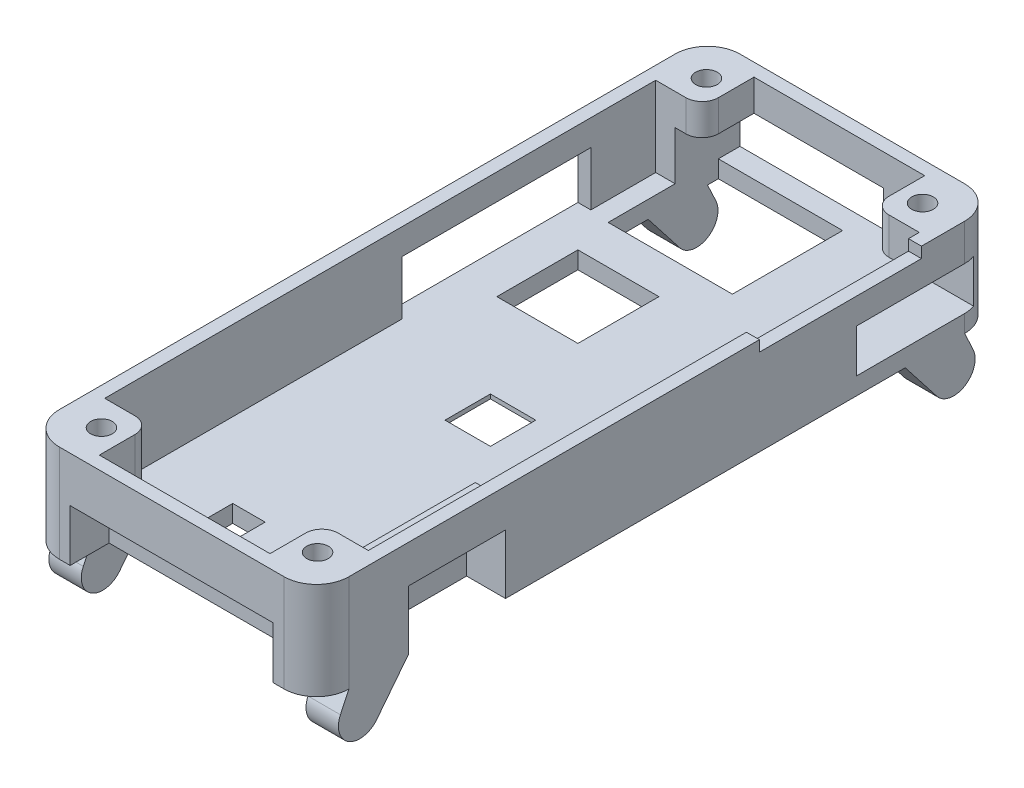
SolidWorks part; units mm, degrees
ref_plane "前视基准面" through (0, 0, 0) normal (0, 0, 1) x (1, 0, 0)
ref_plane "上视基准面" through (0, 0, 0) normal (0, 1, 0) x (1, 0, 0)
ref_plane "右视基准面" through (0, 0, 0) normal (1, 0, 0) x (0, 0, -1)
sketch "草图1" plane through (0, 0, 0) normal (0, 1, 0) x (1, 0, 0)
  line L1 (-13.4, 31.5) -> (13.4, 31.5)
  line L2 (-13.4, 31.5) -> (-13.4, -31.5)
  line L3 (-13.4, -31.5) -> (13.4, -31.5)
  line L4 (13.4, 31.5) -> (13.4, -31.5)
  line L5 (-13.4, 31.5) -> (13.4, -31.5) construction
  line L6 (-13.4, -31.5) -> (13.4, 31.5) construction
  point P0 (0, 0)
  dimension "D1" = 26.8
  dimension "D2" = 63
extrude "凸台-拉伸1" add sketch "草图1" along normal blind 9
fillet "圆角1" radius 3 4 edges at (-13.4, 4.5, 31.5) (-13.4, 4.5, -31.5) (13.4, 4.5, -31.5) (13.4, 4.5, 31.5)
shell "抽壳1" thickness 1.2
sketch "草图2" plane through (0, 1.6, 0) normal (0, 1, 0) x (1, 0, 0)
  line L0 (-10.4, -31.5) -> (10.4, -31.5) construction
  line L1 (0, 0) -> (0, -37.1655) construction
  line L2 (-10.4, -30.3) -> (10.4, -30.3) construction
  line L3 (12.2, -28.5) -> (12.2, 28.5) construction
  line L4 (10, -26.5) -> (9.4, -26.5)
  line L5 (9.4, -26.5) -> (9.4, -26.6252)
  line L6 (12.2, -28.5) -> (12.2, -26.5)
  line L8 (9.4, -30.3) -> (9.4, -26.6252)
  line L9 (10, -26.5) -> (12.2, -26.5)
  line L10 (9.4, -30.3) -> (10.4, -30.3)
  circle A0 centre (10, -28) radius 2.25 construction
  circle A1 centre (-10, -28) radius 2.25 construction
  arc A2 (10.4, -30.3) -> (12.2, -28.5) centre (10.4, -28.5) ccw construction
  arc A4 (10.4, -30.3) -> (12.2, -28.5) centre (10.4, -28.5) ccw
  arc A6 (10, -26.5) -> (9.4, -26.6252) centre (10, -28) ccw construction
  dimension "D2" = 4.5
  dimension "D6" = 3
  dimension "D1" = 20
  dimension "D3" = 3.5
  dimension "D4" = 0.6
  dimension "D5" = 1.5
extrude "凸台-拉伸2" add sketch "草图2" along normal up to surface (7.4 mm away)
sketch "草图3" plane through (0, 9, 0) normal (0, 1, 0) x (1, 0, 0)
  line L0 (13.4, -28.5) -> (13.4, 28.5) construction
  line L1 (-10.4, -31.5) -> (10.4, -31.5) construction
  circle A0 centre (10, -28) radius 1
  dimension "D1" = 2
  dimension "D2" = 3.4
  dimension "D3" = 3.5
mirror "镜向1" about plane through (0, 0, 0) normal (1, 0, 0) of "凸台-拉伸2"
mirror "镜向2" about plane through (0, 0, 0) normal (0, 0, 1) of "镜向1", "凸台-拉伸2"
sketch "草图4" plane through (0, 0, 0) normal (0, -1, 0) x (1, 0, 0)
  line L0 (0, -1000) -> (0, 49000) construction
  line L1 (-9.4, 31.5) -> (9.4, 31.5)
  line L2 (-9.4, 31.5) -> (-9.4, 27.9)
  line L3 (-9.4, 27.9) -> (9.4, 27.9)
  line L4 (9.4, 31.5) -> (9.4, 27.9)
  line L5 (-9.4, 31.5) -> (9.4, 27.9) construction
  line L6 (-9.4, 27.9) -> (9.4, 31.5) construction
  line L7 (-10.4, 31.5) -> (10.4, 31.5) construction
  point P0 (0, 29.7)
  dimension "D1" = 18.8
  dimension "D2" = 3.6
extrude "切除-拉伸1" cut sketch "草图4" against normal blind 4.8
sketch "草图5" plane through (0, 1.6, 0) normal (0, 1, 0) x (1, 0, 0)
  line L0 (9.4, -31.5) -> (-9.4, -31.5) construction
  line L1 (-5.25, -20.6) -> (-2.25, -20.6)
  line L2 (-5.25, -20.6) -> (-5.25, -25.1)
  line L3 (-5.25, -25.1) -> (-2.25, -25.1)
  line L4 (-2.25, -20.6) -> (-2.25, -25.1)
  line L5 (-5.25, -20.6) -> (-2.25, -25.1) construction
  line L6 (-5.25, -25.1) -> (-2.25, -20.6) construction
  line L7 (3.25, -20.6) -> (6.25, -20.6)
  line L8 (3.25, -20.6) -> (3.25, -25.1)
  line L9 (3.25, -25.1) -> (6.25, -25.1)
  line L10 (6.25, -20.6) -> (6.25, -25.1)
  line L11 (3.25, -20.6) -> (6.25, -25.1) construction
  line L12 (3.25, -25.1) -> (6.25, -20.6) construction
  line L13 (-10.4, -31.5) -> (10.4, -31.5) construction
  line L14 (0, -1000) -> (0, 49000) construction
  line L16 (-2.1, 0.1) -> (2.1, 0.1)
  line L17 (-2.1, 0.1) -> (-2.1, -4.1)
  line L18 (-2.1, -4.1) -> (2.1, -4.1)
  line L19 (2.1, 0.1) -> (2.1, -4.1)
  line L20 (-2.1, 0.1) -> (2.1, -4.1) construction
  line L21 (-2.1, -4.1) -> (2.1, 0.1) construction
  point P0 (-3.75, -22.85)
  point P5 (4.75, -22.85)
  point P13 (0, -2)
  dimension "D1" = 6.4
  dimension "D2" = 3
  dimension "D3" = 4.5
  dimension "D4" = 3.75
  dimension "D5" = 4.75
  dimension "D6" = 29.5
  dimension "D7" = 4.2
extrude "切除-拉伸2" cut sketch "草图5" against normal through all
sketch "草图7" plane through (0, 0, 0) normal (0, -1, 0) x (1, 0, 0)
  line L1 (-10.4, -19.3) -> (1.1, -19.3)
  line L2 (-10.4, -19.3) -> (-10.4, -30.3)
  line L3 (-10.4, -30.3) -> (1.1, -30.3)
  line L4 (1.1, -19.3) -> (1.1, -30.3)
  line L5 (-10.4, -19.3) -> (1.1, -30.3) construction
  line L6 (-10.4, -30.3) -> (1.1, -19.3) construction
  line L7 (-13.4, -28.5) -> (-13.4, 28.5) construction
  line L8 (10.4, -31.5) -> (-10.4, -31.5) construction
  line L9 (9.4, 31.5) -> (-9.4, 31.5) construction
  line L10 (-9.6, -8.2) -> (-2.1, -8.2)
  line L11 (-9.6, -8.2) -> (-9.6, -15.7)
  line L12 (-9.6, -15.7) -> (-2.1, -15.7)
  line L13 (-2.1, -8.2) -> (-2.1, -15.7)
  line L14 (-9.6, -8.2) -> (-2.1, -15.7) construction
  line L15 (-9.6, -15.7) -> (-2.1, -8.2) construction
  line L16 (13.4, 28.5) -> (13.4, -28.5) construction
  point P0 (-4.65, -24.8)
  point P10 (-5.85, -11.95)
  dimension "D1" = 11
  dimension "D2" = 11.5
  dimension "D3" = 3
  dimension "D4" = 1.2
  dimension "D5" = 39.7
  dimension "D6" = 7.5
  dimension "D7" = 15.5
extrude "切除-拉伸3" cut sketch "草图7" against normal up to surface (1.6 mm away)
sketch "草图8" plane through (0, 0, 0) normal (0, -1, 0) x (1, 0, 0)
  line L0 (13.4, 28.5) -> (13.4, -28.5) construction
  line L1 (9.4, 23) -> (13.4, 23)
  line L2 (9.4, 23) -> (9.4, 14)
  line L3 (9.4, 14) -> (13.4, 14)
  line L4 (13.4, 23) -> (13.4, 14)
  line L5 (9.4, 23) -> (13.4, 14) construction
  line L6 (9.4, 14) -> (13.4, 23) construction
  line L7 (9.4, 31.5) -> (10.4, 31.5) construction
  point P0 (11.4, 18.5)
  dimension "D1" = 4
  dimension "D2" = 9
  dimension "D3" = 8.5
extrude "切除-拉伸4" cut sketch "草图8" against normal blind 5.5
sketch "草图9" plane through (-13.4, 0, 0) normal (-1, 0, 0) x (0, 0, 1)
  line L0 (-28.5, 0) -> (-29.282, -1.6771)
  line L1 (-25.9199, -3.7373) -> (-23, 0)
  line L2 (-28.5, 0) -> (28.5, 0) construction
  line L3 (-23, 0) -> (-28.5, 0)
  line L4 (-31.5, 0) -> (-28.5, 0) construction
  line L5 (-35.2033, -4.5) -> (-21.0062, -4.5) construction
  arc A0 (-29.282, -1.6771) -> (-25.9199, -3.7373) centre (-27.4836, -2.5157) ccw
  dimension "D1" = 128
  dimension "D2" = 65
  dimension "D3" = 5.5
  dimension "D4" = 4.5
extrude "凸台-拉伸4" add sketch "草图9" against normal blind 3
mirror "镜向3" about plane through (0, 0, 0) normal (0, 0, 1) of "凸台-拉伸4"
mirror "镜向4" about plane through (0, 0, 0) normal (1, 0, 0) of "镜向3", "凸台-拉伸4"
sketch "草图10" plane through (12.2, 0, 0) normal (-1, 0, 0) x (0, 0, 1)
  line L1 (14, 6.7) -> (23, 6.7)
  line L2 (14, 6.7) -> (14, 5.5)
  line L3 (14, 5.5) -> (23, 5.5)
  line L4 (23, 6.7) -> (23, 5.5)
  line L5 (14, 6.7) -> (23, 5.5) construction
  line L6 (14, 5.5) -> (23, 6.7) construction
  line L7 (14, 5.5) -> (23, 5.5) construction
  line L8 (23, 1.6) -> (23, 5.5) construction
  line L9 (14, 5.5) -> (14, 1.6) construction
  point P0 (18.5, 6.1)
  dimension "D1" = 1.2
extrude "凸台-拉伸5" add sketch "草图10" along normal up to surface (2.8 mm away)
sketch "草图11" plane through (0, 9, 0) normal (0, 1, 0) x (1, 0, 0)
  line L1 (11.2, -15.5) -> (12.2, -15.5)
  line L2 (11.2, -15.5) -> (11.2, -21.5)
  line L3 (11.2, -21.5) -> (12.2, -21.5)
  line L4 (12.2, -15.5) -> (12.2, -21.5)
  line L5 (11.2, -15.5) -> (12.2, -21.5) construction
  line L6 (11.2, -21.5) -> (12.2, -15.5) construction
  line L10 (12.2, -26.5) -> (12.2, 26.5) construction
  point P0 (11.7, -18.5)
  point P14 (11.7, -18.5)
  dimension "D1" = 1
  dimension "D2" = 6
extrude "切除-拉伸7" cut sketch "草图11" against normal up to next
sketch "草图12" plane through (0, 0, 14) normal (0, 0, -1) x (-1, 0, 0)
  line L1 (-12.2, 6.7) -> (-9.4, 6.7)
  line L2 (-12.2, 6.7) -> (-12.2, 1.6)
  line L3 (-12.2, 1.6) -> (-9.4, 1.6)
  line L4 (-9.4, 6.7) -> (-9.4, 1.6)
extrude "凸台-拉伸6" add sketch "草图12" along normal blind 1.2
sketch "草图13" plane through (0, 0, 23) normal (0, 0, 1) x (1, 0, 0)
  line L1 (12.2, 6.7) -> (9.4, 6.7)
  line L2 (12.2, 6.7) -> (12.2, 1.6)
  line L3 (12.2, 1.6) -> (9.4, 1.6)
  line L4 (9.4, 6.7) -> (9.4, 1.6)
extrude "凸台-拉伸7" add sketch "草图13" along normal blind 1.2
sketch "草图14" plane through (0, 4.8, 0) normal (0, -1, 0) x (1, 0, 0)
  line L0 (-9.4, 30.3) -> (9.4, 30.3) construction
  line L1 (-9.4, 26.5) -> (-7.9, 26.5)
  line L2 (-9.4, 26.5) -> (-9.4, 30.3)
  line L3 (-9.4, 30.3) -> (-7.9, 30.3)
  line L4 (-7.9, 26.5) -> (-7.9, 30.3)
  line L6 (9.4, 26.5) -> (7.9, 26.5)
  line L7 (9.4, 26.5) -> (9.4, 30.3)
  line L8 (9.4, 30.3) -> (7.9, 30.3)
  line L9 (7.9, 26.5) -> (7.9, 30.3)
  dimension "D1" = 1.5
extrude "凸台-拉伸11" add sketch "草图14" against normal up to surface (4.2 mm away)
mirror "镜向7" about plane through (0, 0, 0) normal (0, 0, 1) of "凸台-拉伸11"
sketch "草图16" plane through (0, 0, 26.5) normal (0, 0, -1) x (-1, 0, 0)
  line L0 (12.2, 1.6) -> (9.4, 1.6) construction
  line L1 (9.4, 4.8) -> (9.4, 1.6) construction
  line L2 (9.4, 4.8) -> (7.9, 4.8) construction
  line L3 (7.9, 9) -> (7.9, 4.8) construction
  line L4 (12.2, 9) -> (7.9, 9) construction
  line L5 (12.2, 9) -> (12.2, 1.6) construction
  line L6 (12.2, 1.6) -> (9.4, 1.6)
  line L7 (9.4, 4.8) -> (9.4, 1.6)
  line L8 (9.4, 4.8) -> (7.9, 4.8)
  line L9 (7.9, 9) -> (7.9, 4.8)
  line L10 (12.2, 9) -> (7.9, 9)
  line L11 (12.2, 9) -> (12.2, 1.6)
extrude "凸台-拉伸12" add sketch "草图16" along normal blind 1
mirror "镜向8" about plane through (0, 0, 0) normal (1, 0, 0) of "凸台-拉伸12"
mirror "镜向9" about plane through (0, 0, 0) normal (0, 0, 1) of "镜向8", "凸台-拉伸12"
extrude "切除-拉伸8" cut sketch "草图3" against normal blind 4
mirror "镜向10" about plane through (0, 0, 0) normal (1, 0, 0) of "切除-拉伸8"
mirror "镜向11" about plane through (0, 0, 0) normal (0, 0, 1) of "镜向10", "切除-拉伸8"
fillet "圆角2" radius 1.5 8 edges at (-7.9, 6.9, 25.5) (-8.65, 4.8, 25.5) (8.65, 4.8, 25.5) (7.9, 6.9, 25.5) (7.9, 6.9, -25.5) (8.65, 4.8, -25.5) (-8.65, 4.8, -25.5) (-7.9, 6.9, -25.5)
sketch "草图18" plane through (13.4, 0, 0) normal (1, 0, 0) x (0, 0, -1)
  line L0 (-12.8, 1.6) -> (25.5, 1.6) construction
  line L1 (29.5, 5.6) -> (18.5, 5.6)
  line L2 (29.5, 5.6) -> (29.5, 1.6)
  line L3 (29.5, 1.6) -> (18.5, 1.6)
  line L4 (18.5, 5.6) -> (18.5, 1.6)
  line L5 (31.5, 9) -> (31.5, 0) construction
  dimension "D1" = 4
  dimension "D2" = 11
  dimension "D3" = 2
extrude "切除-拉伸9" cut sketch "草图18" against normal up to next
sketch "草图19" plane through (0, 0, 0) normal (0, -1, 0) x (1, 0, 0)
  line L0 (10.4, -31.5) -> (-10.4, -31.5) construction
  line L1 (-9.4, -30.3) -> (1.1, -30.3)
  line L2 (-9.4, -30.3) -> (-9.4, -31.5)
  line L3 (-9.4, -31.5) -> (1.1, -31.5)
  line L4 (1.1, -30.3) -> (1.1, -31.5)
  line L5 (1.1, -30.3) -> (1.1, -19.3) construction
extrude "切除-拉伸10" cut sketch "草图19" against normal up to surface (4.8 mm away)
sketch "草图20" plane through (0, 0, 0) normal (0, -1, 0) x (1, 0, 0)
  line L0 (9.4, 14) -> (13.4, 14) construction
  line L1 (9.4, 23) -> (9.8, 23)
  line L2 (9.4, 23) -> (9.4, 14)
  line L3 (9.4, 14) -> (9.8, 14)
  line L4 (9.8, 23) -> (9.8, 14)
  dimension "D1" = 0.4
extrude "凸台-拉伸13" add sketch "草图20" against normal up to surface (5.5 mm away)
sketch "草图21" plane through (0, 0, -31.5) normal (0, 0, -1) x (-1, 0, 0)
  line L0 (-1.1, 1.6) -> (10.4, 1.6) construction
  line L1 (-4.1, 6.1) -> (10.4, 6.1)
  line L2 (-4.1, 6.1) -> (-4.1, 1.6)
  line L3 (-4.1, 1.6) -> (10.4, 1.6)
  line L4 (10.4, 6.1) -> (10.4, 1.6)
  line L5 (-4.1, 6.1) -> (10.4, 1.6) construction
  line L6 (-4.1, 1.6) -> (10.4, 6.1) construction
  line L11 (10.4, 0) -> (10.4, 9) construction
  point P0 (3.15, 3.85)
  dimension "D1" = 14.5
  dimension "D2" = 4.5
extrude "切除-拉伸12" cut sketch "草图21" against normal blind 10
sketch "草图23" plane through (0, 0, 0) normal (0, -1, 0) x (1, 0, 0)
  line L0 (-2.1, 4.1) -> (2.1, -0.1) construction
  line L1 (2.1, -0.1) -> (2.1, 4.1) construction
  line L2 (2.1, 4.1) -> (-2.1, -0.1) construction
  circle A0 centre (0, 2) radius 10.3
  point P4 (0, 2)
  dimension "D1" = 20.6
extrude "切除-拉伸15" cut sketch "草图23" against normal blind 1.2
sketch "草图24" plane through (0, 0, 0) normal (0, -1, 0) x (1, 0, 0)
  line L1 (-10.4, -31.5) -> (1.1, -31.5)
  line L2 (-10.4, -31.5) -> (-10.4, -29.5)
  line L3 (-10.4, -29.5) -> (1.1, -29.5)
  line L4 (1.1, -31.5) -> (1.1, -29.5)
  line L5 (10.4, -31.5) -> (1.1, -31.5) construction
  line L10 (-10.4, -28.5) -> (-10.4, -30.3) construction
  dimension "D1" = 2
  dimension "D2" = 11.5
extrude "凸台-拉伸14" add sketch "草图24" against normal up to surface (1.6 mm away)
sketch "草图25" plane through (0, 9, 0) normal (0, 1, 0) x (1, 0, 0)
  line L0 (12.2, -25.5) -> (12.2, 25.5) construction
  line L1 (12.2, 24.5) -> (13.4, 24.5)
  line L2 (12.2, 24.5) -> (12.2, 9.5)
  line L3 (12.2, 9.5) -> (13.4, 9.5)
  line L4 (13.4, 24.5) -> (13.4, 9.5)
  line L5 (13.4, -28.5) -> (13.4, 28.5) construction
  line L6 (10.4, 31.5) -> (-10.4, 31.5) construction
  dimension "D1" = 15
  dimension "D2" = 7
extrude "切除-拉伸16" cut sketch "草图25" against normal blind 1
sketch "草图26" plane through (-13.4, 0, 0) normal (-1, 0, 0) x (0, 0, 1)
  line L0 (-25.5, 1.6) -> (25.5, 1.6) construction
  line L1 (-19.5, 6.6) -> (-2, 6.6)
  line L2 (-19.5, 6.6) -> (-19.5, 1.6)
  line L3 (-19.5, 1.6) -> (-2, 1.6)
  line L4 (-2, 6.6) -> (-2, 1.6)
  line L5 (-19.5, 6.6) -> (-2, 1.6) construction
  line L6 (-19.5, 1.6) -> (-2, 6.6) construction
  line L7 (-31.5, 1.6) -> (-31.5, 6.1) construction
  point P0 (-10.75, 4.1)
  dimension "D1" = 17.5
  dimension "D2" = 5
  dimension "D3" = 12
extrude "切除-拉伸17" cut sketch "草图26" against normal up to surface (1.2 mm away)
